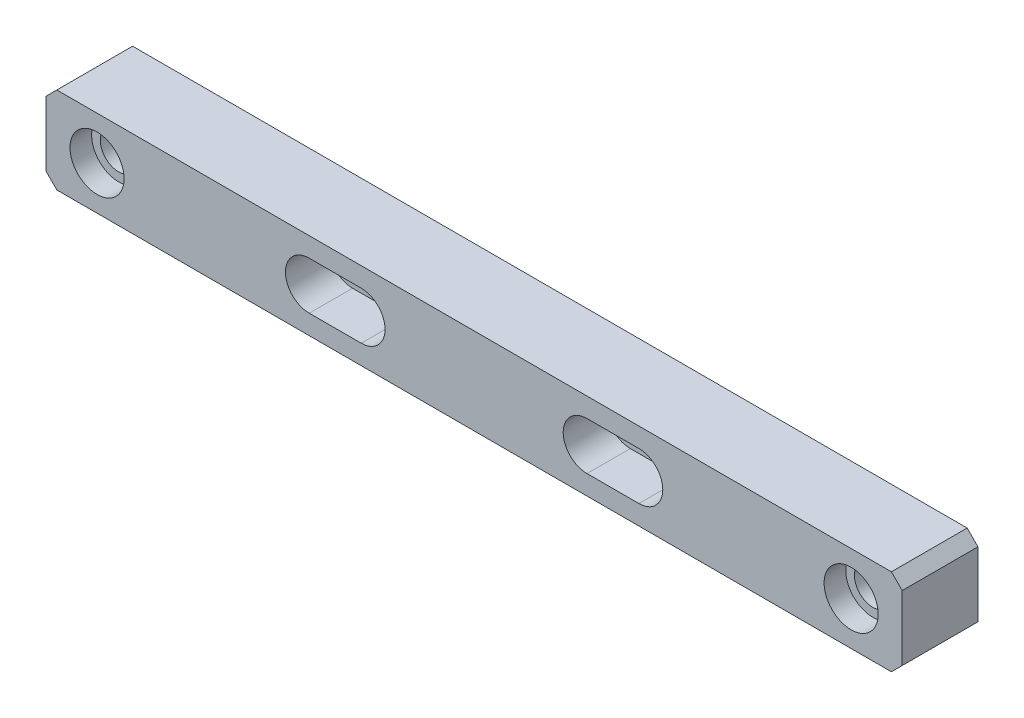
SolidWorks part; units mm, degrees
ref_plane "Plan de face" through (0, 0, 0) normal (0, 0, 1) x (1, 0, 0)
ref_plane "Plan de dessus" through (0, 0, 0) normal (0, 1, 0) x (1, 0, 0)
ref_plane "Plan de droite" through (0, 0, 0) normal (1, 0, 0) x (0, 0, -1)
sketch "Esquisse1" plane through (0, 0, 126.5857) normal (0, 0, -1) x (-1, 0, 0)
  line L1 (-68.9816, -291.4742) -> (326.4221, -291.4742)
  line L2 (-68.9816, -291.4742) -> (-68.9816, -331.4742)
  line L3 (-68.9816, -331.4742) -> (326.4221, -331.4742)
  line L4 (326.4221, -291.4742) -> (326.4221, -331.4742)
  dimension "D2" = 20
  dimension "D1" = 40
extrude "Boss.-Extru.1" add sketch "Esquisse1" along normal blind 35
sketch "Esquisse7" plane through (0, 0, 126.5857) normal (0, 0, 1) x (1, 0, 0)
  line L0 (-204.8502, -311.4742) -> (-180.8502, -311.4742) construction
  line L1 (-204.8502, -300.4742) -> (-180.8502, -300.4742)
  line L2 (-204.8502, -322.4742) -> (-180.8502, -322.4742)
  line L3 (-76.5902, -311.4742) -> (-52.5902, -311.4742) construction
  line L4 (-76.5902, -300.4742) -> (-52.5902, -300.4742)
  line L5 (-76.5902, -322.4742) -> (-52.5902, -322.4742)
  line L6 (-182.6522, -300.4742) -> (-203.0483, -300.4742) construction
  arc A0 (-204.8502, -300.4742) -> (-204.8502, -322.4742) centre (-204.8502, -311.4742) ccw
  arc A1 (-180.8502, -322.4742) -> (-180.8502, -300.4742) centre (-180.8502, -311.4742) ccw
  arc A2 (-76.5902, -300.4742) -> (-76.5902, -322.4742) centre (-76.5902, -311.4742) ccw
  arc A3 (-52.5902, -322.4742) -> (-52.5902, -300.4742) centre (-52.5902, -311.4742) ccw
  point P2 (-192.8502, -311.4742)
  point P7 (-64.5902, -311.4742)
  dimension "D1" = 12
  dimension "D2" = 11
  dimension "D3" = 12
  dimension "D4" = 12
  dimension "D5" = 12
extrude "Enlèv. mat.-Extru.5" cut sketch "Esquisse7" against normal blind 20
sketch "Esquisse3" plane through (0, 0, 91.5857) normal (0, 0, -1) x (-1, 0, 0)
  circle A0 centre (64.5902, -311.4742) radius 8.5
  circle A1 centre (192.8502, -311.4742) radius 8.5
  dimension "D1" = 17
  dimension "D2" = 17
extrude "Enlèv. mat.-Extru.2" cut sketch "Esquisse3" against normal through all
chamfer "Chanfrein1" distance 5 angle 45 4 edges at (-326.4221, -331.4742, 109.0857) (-326.4221, -291.4742, 109.0857) (68.9816, -331.4742, 109.0857) (68.9816, -291.4742, 109.0857)
sketch "Esquisse4" plane through (0, 0, 126.5857) normal (0, 0, 1) x (1, 0, 0)
  line L2 (63.9816, -331.4742) -> (-321.4221, -331.4742) construction
  circle A0 centre (-302.8502, -311.4742) radius 12.5
  circle A1 centre (45.4098, -311.4742) radius 12.5
  dimension "D1" = 25
  dimension "D2" = 25
  dimension "D3" = 110
  dimension "D4" = 110
  dimension "D6" = 20
  dimension "D5" = 20
extrude "Enlèv. mat.-Extru.3" cut sketch "Esquisse4" against normal blind 10
sketch "Esquisse5" plane through (0, 0, 116.5857) normal (0, 0, 1) x (1, 0, 0)
  circle A0 centre (-302.8502, -311.4742) radius 8.5
  circle A1 centre (45.4098, -311.4742) radius 8.5
  dimension "D1" = 17
  dimension "D2" = 17
extrude "Enlèv. mat.-Extru.4" cut sketch "Esquisse5" against normal through all
